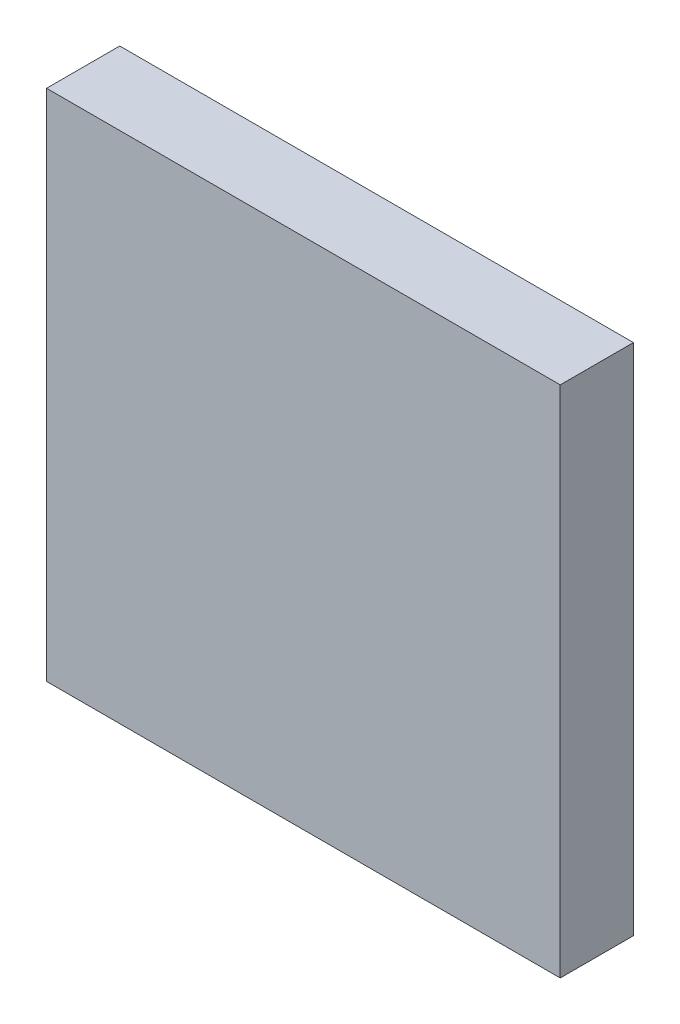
SolidWorks part; units mm, degrees
ref_plane "Piano frontale" through (0, 0, 0) normal (0, 0, 1) x (1, 0, 0)
ref_plane "Piano superiore" through (0, 0, 0) normal (0, 1, 0) x (1, 0, 0)
ref_plane "Piano destro" through (0, 0, 0) normal (1, 0, 0) x (0, 0, -1)
sketch "Sketch1" plane through (0, 0, 0) normal (0, 0, 1) x (1, 0, 0)
  line L1 (234.2564, 76.8166) -> (274.2564, 76.8166)
  line L2 (234.2564, 76.8166) -> (234.2564, 36.8166)
  line L3 (234.2564, 36.8166) -> (274.2564, 36.8166)
  line L4 (274.2564, 76.8166) -> (274.2564, 36.8166)
extrude "Boss-Extrude1" add sketch "Sketch1" along normal blind 5.7
equation "\"lh\"= 40mm"
equation "\"D1@Sketch1\"=\"lh\""
equation "\"D2@Sketch1\"=\"lh\""
equation "\"h\"= 5.7mm"
equation "\"D1@Boss-Extrude1\"=\"h\""
